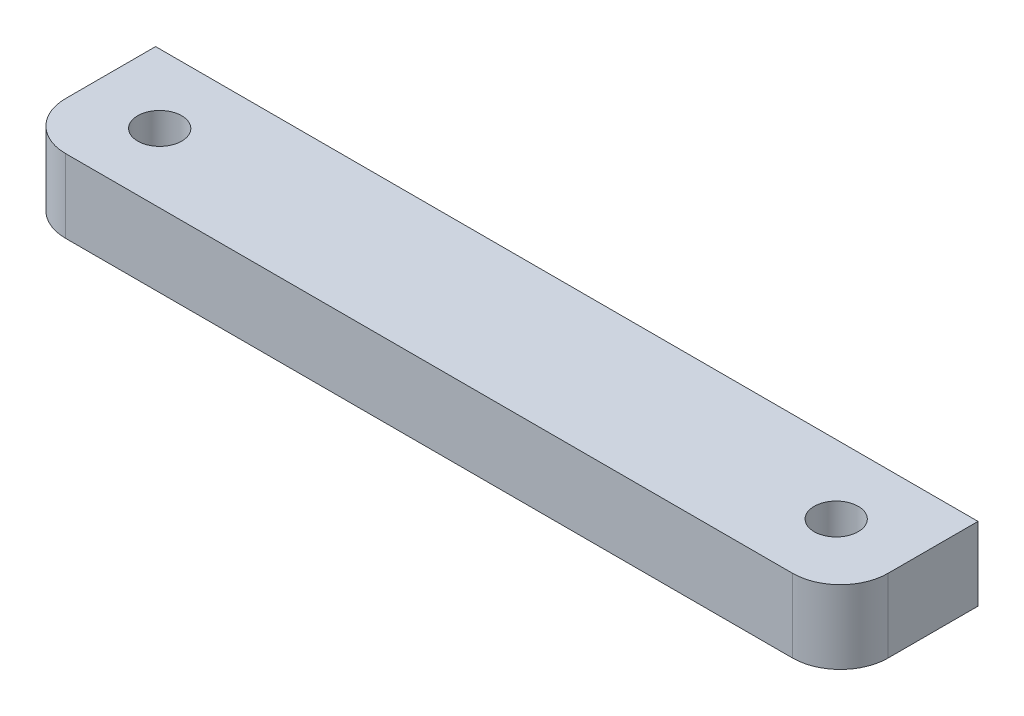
SolidWorks part; units mm, degrees
ref_plane "Front Plane" through (0, 0, 0) normal (0, 0, 1) x (1, 0, 0)
ref_plane "Top Plane" through (0, 0, 0) normal (0, 1, 0) x (1, 0, 0)
ref_plane "Right Plane" through (0, 0, 0) normal (1, 0, 0) x (0, 0, -1)
sketch "Sketch1" plane through (0, 0, 0) normal (0, 1, 0) x (1, 0, 0)
  line L1 (-14.224, 4.7625) -> (14.224, 4.7625)
  line L2 (-14.224, 4.7625) -> (-14.224, -4.7625)
  line L3 (-14.224, -4.7625) -> (14.224, -4.7625)
  line L4 (14.224, 4.7625) -> (14.224, -4.7625)
  line L5 (-14.224, 4.7625) -> (14.224, -4.7625) construction
  line L6 (-14.224, -4.7625) -> (14.224, 4.7625) construction
  point P0 (0, 0)
  dimension "D1" = 28.448
  dimension "D2" = 9.525
extrude "Plate" add sketch "Sketch1" along normal blind 5.08
fillet "Fillet1" radius 3.302 1 edges at (-14.224, 2.54, 4.7625)
sketch "Sketch2" plane through (0, 5.08, 0) normal (0, 1, 0) x (1, 0, 0)
  line L0 (14.224, -4.7625) -> (14.224, 4.7625) construction
  circle A0 centre (-9.177, 0) radius 1.524
  dimension "D1" = 3.048
  dimension "D2" = 23.401
extrude "4-40ThruHole" cut sketch "Sketch2" against normal through all
mirror "Mirror1" about plane through (0, 5.08, 0) normal (0, 1, 0) of "Plate", "Fillet1", "4-40ThruHole"
